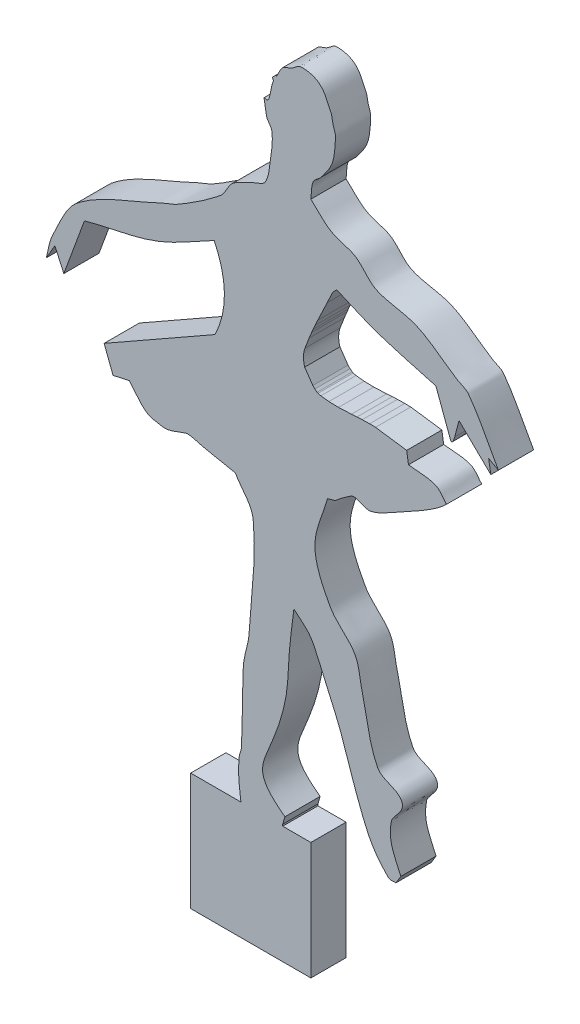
SolidWorks part; units mm, degrees
ref_plane "Alzado" through (0, 0, 0) normal (0, 0, 1) x (1, 0, 0)
ref_plane "Planta" through (0, 0, 0) normal (0, 1, 0) x (1, 0, 0)
ref_plane "Vista lateral" through (0, 0, 0) normal (1, 0, 0) x (0, 0, -1)
sketch "Croquis4" plane through (0, 0, 0) normal (0, 0, 1) x (1, 0, 0)
  line L0 (1069.8862, -9982.1073) -> (1096.5761, -9982.1073) construction
  line L1 (1102.5614, -9982.0997) -> (1101.7304, -9981.6452)
  line L3 (1101.7304, -9981.6452) -> (1101.914, -9982.7471)
  line L4 (1101.914, -9982.7471) -> (1099.2069, -9980.1163)
  line L5 (1099.2069, -9980.1163) -> (1098.8413, -9981.4945)
  line L7 (1098.4831, -9981.9057) -> (1097.2342, -9978.547)
  line L8 (1094.7459, -9984.5391) -> (1094.8984, -9985.5305)
  line L9 (1094.2502, -10016.2238) -> (1093.8308, -10016.9101)
  line L10 (1084.375, -10016.7576) -> (1084.1843, -10017.4058)
  line L12 (1071.1055, -9991.2124) -> (1069.7328, -9991.5175)
  line L13 (1069.7328, -9991.5175) -> (1068.9703, -9989.5348)
  line L14 (1068.9703, -9989.5348) -> (1078.4261, -9984.1587)
  line L15 (1067.2926, -9981.3372) -> (1065.5387, -9986.1032)
  line L16 (1065.5387, -9986.1032) -> (1064.7761, -9984.4256)
  line L17 (1064.7761, -9984.4256) -> (1064.0517, -9985.6838)
  line L19 (1083.4028, -9962.9472) -> (1083.3065, -9962.7305)
  line L20 (1083.3065, -9962.7305) -> (1083.5734, -9962.4636)
  line L21 (1083.5734, -9962.4636) -> (1083.6497, -9962.5018)
  line L27 (1084.1843, -10017.4058) -> (1084.375, -10016.7576)
  line L28 (1057.3314, -9960.8458) -> (1057.3314, -10026.2108)
  line L29 (1080.5994, -10017.3685) -> (1080.6272, -10017.5493)
  line L30 (1076.3456, -10017.5493) -> (1080.6272, -10017.5493)
  line L35 (1076.3456, -10017.5493) -> (1076.3456, -10027.5493)
  line L36 (1076.3456, -10027.5493) -> (1086.5856, -10027.5493)
  line L37 (1086.5856, -10017.5493) -> (1086.5856, -10027.5493)
  line L38 (1084.1843, -10017.4058) -> (1084.1843, -10017.5493)
  line L39 (1084.1843, -10017.5493) -> (1086.5856, -10017.5493)
  line L40 (1094.7459, -9984.5391) -> (1092.0915, -9984.1685)
  line L41 (1092.0915, -9984.1685) -> (1091.5875, -9984.1566)
  line L42 (1091.5875, -9984.1566) -> (1090.9595, -9984.173)
  line L43 (1090.9595, -9984.173) -> (1090.5104, -9984.1966)
  line L44 (1090.5104, -9984.1966) -> (1090.0409, -9984.2251)
  line L45 (1090.0409, -9984.2251) -> (1088.9419, -9984.2732)
  line L46 (1088.9419, -9984.2732) -> (1088.1172, -9984.2538)
  line L47 (1088.1172, -9984.2538) -> (1087.4347, -9984.1733)
  line L48 (1087.4347, -9984.1733) -> (1087.1951, -9984.1113)
  line L49 (1087.1951, -9984.1113) -> (1087.1127, -9984.071)
  line L50 (1087.1127, -9984.071) -> (1086.9204, -9983.9308)
  line L51 (1086.9204, -9983.9308) -> (1086.7524, -9983.7528)
  line L52 (1086.7524, -9983.7528) -> (1086.0567, -9982.7471)
  line L53 (1086.0805, -9981.3372) -> (1086.431, -9980.4183)
  line L54 (1086.431, -9980.4183) -> (1086.6588, -9979.8715)
  line L55 (1086.6588, -9979.8715) -> (1086.785, -9979.5803)
  line L56 (1086.785, -9979.5803) -> (1086.946, -9979.2181)
  line L57 (1086.946, -9979.2181) -> (1087.1661, -9978.7366)
  line L58 (1087.1661, -9978.7366) -> (1087.9738, -9977.0327)
  line L59 (1087.9738, -9977.0327) -> (1088.4623, -9975.9968)
  line L61 (1092.8353, -9977.2977) -> (1094.6199, -9977.8259)
  line L62 (1094.6199, -9977.8259) -> (1095.769, -9978.1393)
  line L63 (1095.769, -9978.1393) -> (1097.2342, -9978.547)
  line L64 (1088.4623, -9975.9968) -> (1088.8004, -9975.6775)
  spline S0 degree 3 poles (1083.6497, -9962.5018) (1083.7591, -9962.2555) (1083.9978, -9961.7956) (1084.1835, -9961.5867) (1084.2975, -9961.4584) (1084.7754, -9961.341) (1084.9461, -9961.2435) (1085.228, -9961.0824) (1085.4602, -9960.7531) (1085.7849, -9960.7478) (1086.3156, -9960.7393) (1086.8987, -9960.87) (1087.31, -9961.2054) (1087.783, -9961.5911) (1087.9974, -9962.2193) (1088.2632, -9962.7687) (1088.3827, -9963.0156) (1088.3887, -9963.3028) (1088.4539, -9963.5693) (1088.5285, -9963.8748) (1088.6976, -9964.1704) (1088.6826, -9964.4844) (1088.5936, -9966.3536) (1088.4856, -9966.726) (1087.4625, -9968.0304) (1087.2629, -9968.2849) (1086.903, -9968.419) (1086.7762, -9968.7167) (1086.5952, -9969.1417) (1086.6491, -9969.6318) (1086.5856, -9970.0893) knots 0 0 0 0 1 1 1 2 2 2 3 3 3 4 4 4 5 5 5 6 6 6 7 7 7 8 8 8 9 9 9 10 10 10 10
  spline S1 degree 3 poles (1086.5856, -9970.0893) (1087.1448, -9970.585) (1087.627, -9971.1843) (1088.2632, -9971.5763) (1088.9042, -9971.9712) (1089.7198, -9972.0195) (1090.3603, -9972.4151) (1091.0347, -9972.8317) (1091.4383, -9973.6342) (1092.1523, -9973.9784) (1093.2469, -9974.506) (1094.5565, -9974.4613) (1095.6601, -9974.9697) (1096.8448, -9975.5155) (1097.8423, -9976.3991) (1098.9392, -9977.1049) (1099.304, -9977.3397) (1099.7902, -9977.4401) (1100.0449, -9977.7912) (1101.0213, -9979.1377) (1101.7226, -9980.6636) (1102.5614, -9982.0997) knots 0 0 0 0 1 1 1 2 2 2 3 3 3 4 4 4 5 5 5 6 6 6 7 7 7 7
  spline S2 degree 3 poles (1097.2342, -9978.547) (1095.5693, -9978.0641) (1093.8765, -9977.6684) (1092.2394, -9977.0981) (1091.0681, -9976.6901) (1089.9383, -9976.1731) (1088.8004, -9975.6775) knots 0 0 0 0 1 1 1 1.797437 1.797437 1.797437 1.797437
  spline S3 degree 3 poles (1098.4831, -9981.9057) (1098.5937, -9982.0964) (1098.7131, -9981.9593) (1098.8413, -9981.4945) knots 0.232918 0.232918 0.232918 0.232918 1 1 1 1
  spline S4 degree 3 poles (1094.8984, -9985.5305) (1095.661, -9985.6449) (1096.4702, -9985.5873) (1097.1861, -9985.8736) (1097.6033, -9986.0405) (1097.8216, -9986.5091) (1098.1393, -9986.8269) knots 0 0 0 0 1 1 1 2 2 2 2
  spline S5 degree 3 poles (1098.1393, -9986.8269) (1097.4278, -9987.5977) (1095.4058, -9988.7216) (1094.4409, -9989.2289) (1093.5403, -9989.7024) (1092.6853, -9990.327) (1091.6956, -9990.5634) (1091.1327, -9990.6979) (1090.4615, -9989.9755) (1089.9799, -9990.2965) (1088.1959, -9991.4858) (1089.1582, -9991.1468) (1087.9972, -9991.4785) knots 0 0 0 0 1 1 1 2 2 2 3 3 3 4 4 4 4
  spline S6 degree 3 poles (1087.9972, -9991.4785) (1087.6413, -9992.8511) (1086.8883, -9994.179) (1086.9296, -9995.5964) (1086.968, -9996.9142) (1087.5912, -9998.1775) (1088.226, -9999.333) (1088.7424, -10000.2729) (1089.7965, -10000.8388) (1090.323, -10001.7732) (1090.7225, -10002.4822) (1090.7262, -10003.3501) (1090.9331, -10004.1371) (1091.3743, -10005.8157) (1091.4763, -10007.6253) (1092.2676, -10009.1701) (1092.6066, -10009.8321) (1093.6246, -10009.85) (1094.1359, -10010.3902) (1094.9321, -10011.2315) (1093.5656, -10011.9451) (1093.4495, -10012.5254) (1093.1321, -10014.1127) (1093.6779, -10014.9109) (1094.2502, -10016.2238) knots 0 0 0 0 1 1 1 2 2 2 3 3 3 4 4 4 5 5 5 6 6 6 7 7 7 8 8 8 8
  spline S7 degree 3 poles (1093.8308, -10016.9101) (1093.6148, -10016.8847) (1093.3378, -10016.9864) (1093.1826, -10016.8339) (1091.7267, -10015.4026) (1091.2933, -10014.1866) (1090.5899, -10012.3347) (1089.889, -10010.4893) (1089.3884, -10008.564) (1088.5691, -10006.768) (1086.4028, -10002.0187) (1087.0812, -10002.6934) (1085.1376, -10001.0487) knots 0 0 0 0 1 1 1 2 2 2 3 3 3 4 4 4 4
  spline S8 degree 3 poles (1085.1376, -10001.0487) (1085.0232, -10001.9892) (1084.8931, -10002.928) (1084.7944, -10003.8702) (1084.6389, -10005.3557) (1084.6934, -10006.872) (1084.375, -10008.3313) (1083.2252, -10013.6011) (1080.7341, -10014.0607) (1084.375, -10016.7576) knots 0 0 0 0 1 1 1 2 2 2 3 3 3 3
  spline S9 degree 3 poles (1080.5994, -10017.3685) (1080.4585, -10016.3352) (1080.3425, -10015.2751) (1080.485, -10014.242) (1080.5208, -10013.9824) (1080.6625, -10013.7411) (1080.6757, -10013.4794) (1080.7772, -10011.4605) (1080.7123, -10009.4351) (1080.8282, -10007.417) (1080.8801, -10006.5136) (1081.2722, -10005.6514) (1081.3239, -10004.748) (1081.4871, -10001.8907) (1081.9661, -9999.0154) (1081.667, -9996.1691) (1081.5599, -9995.1501) (1080.6503, -9994.3898) (1080.1419, -9993.5001) knots 0 0 0 0 1 1 1 2 2 2 3 3 3 4 4 4 5 5 5 6 6 6 6
  spline S10 degree 3 poles (1080.1419, -9993.5001) (1079.1918, -9993.3325) (1078.2617, -9993.1328) (1077.3204, -9992.9282) (1076.8893, -9992.8345) (1076.4649, -9992.6447) (1076.024, -9992.6613) (1075.7269, -9992.6725) (1074.6048, -9993.3114) (1073.9651, -9993.1951) (1073.4979, -9993.1102) (1072.9827, -9993.0844) (1072.5925, -9992.8138) (1071.9938, -9992.3988) (1071.6011, -9991.7462) (1071.1055, -9991.2124) knots 0 0 0 0 1 1 1 2 2 2 3 3 3 4 4 4 5 5 5 5
  spline S11 degree 2 poles (1078.4261, -9984.1587) (1080.0512, -9980.7931) (1078.3499, -9977.2574) knots 0 0 0 0.498057 0.498057 0.498057
  spline S12 degree 3 poles (1078.3499, -9977.2574) (1076.7358, -9978.0836) (1075.2008, -9979.0872) (1073.5075, -9979.7358) (1071.5098, -9980.5011) (1069.3496, -9980.7495) (1067.2926, -9981.3372) knots 0 0 0 0 1 1 1 2 2 2 2
  spline S13 degree 3 poles (1064.0517, -9985.6838) (1064.2207, -9985.0586) (1064.2692, -9984.3874) (1064.5587, -9983.8081) (1065.1797, -9982.5655) (1065.6593, -9981.1184) (1066.7579, -9980.2685) (1068.7451, -9978.731) (1071.238, -9977.992) (1073.4972, -9976.8927) (1074.0915, -9976.6035) (1074.7495, -9976.444) (1075.3163, -9976.1041) (1076.5587, -9975.3589) (1077.7919, -9974.5793) (1078.9037, -9973.6504) (1079.3427, -9973.2837) (1079.4744, -9972.6297) (1079.9135, -9972.2632) (1080.4284, -9971.8334) (1081.1034, -9971.6438) (1081.6923, -9971.3226) (1082.0369, -9971.1346) (1082.5236, -9971.0796) (1082.7134, -9970.736) (1083.0608, -9970.1073) (1083.08, -9969.3435) (1083.1791, -9968.6321) (1083.2651, -9968.0141) (1083.3509, -9967.3806) (1083.2667, -9966.7623) (1083.2192, -9966.4131) (1082.8625, -9966.1618) (1082.7956, -9965.8158) (1082.36, -9963.5631) (1082.7687, -9965.2233) (1083.0418, -9964.3632) (1083.1892, -9963.899) (1083.1912, -9963.3859) (1083.4028, -9962.9472) knots 0 0 0 0 1 1 1 2 2 2 3 3 3 4 4 4 5 5 5 6 6 6 7 7 7 8 8 8 9 9 9 10 10 10 11 11 11 12 12 12 13 13 13 13
  spline S14 degree 2 poles (1086.0567, -9982.7471) (1085.8341, -9982.0014) (1086.0805, -9981.3372) knots 0 0 0 1 1 1
extrude "Saliente-Extruir3" add sketch "Croquis4" along normal blind 3 contours L0 S11 L14 L13 L12 S10 S9 L29 L30 L35 L36 L37 L39 L38 L10 S8 S7 L9 S6 S5 S4 L8 L40 L41 L42 L43 L44 L45 L46 L47 L48 L49 L50 L51 L52 S14 | S11 L0 S14 L53 L54 L55 L56 L57 L58 L59 L64 S2 L61 L62 L7 S3 L5 L4 L3 L1 S1 S0 L21 L20 L19 S13 L17 L16 L15 S12
equation "\"kerf\"= 0.24"
equation "\"mwk\"= \"mw\" + \"kerf\""
equation "\"mw\" = 3"
equation "\"D2@Croquis4\"=10+\"kerf\""
